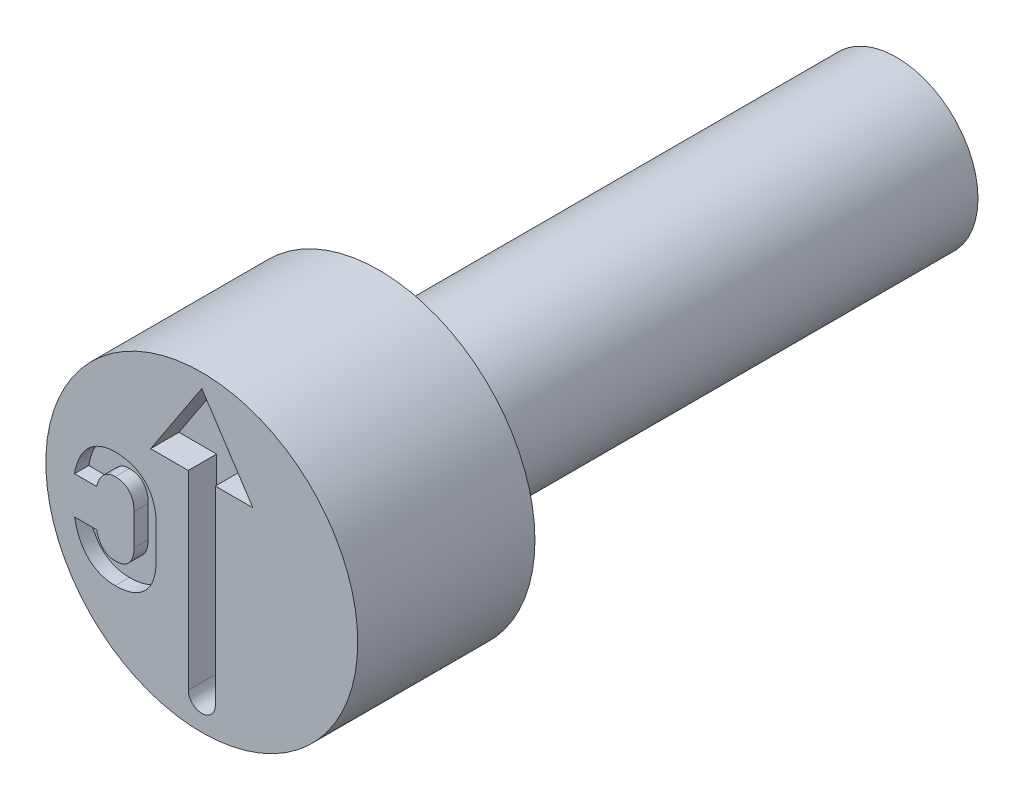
SolidWorks part; units mm, degrees
ref_plane "Front Plane" through (0, 0, 0) normal (0, 0, 1) x (1, 0, 0)
ref_plane "Top Plane" through (0, 0, 0) normal (0, 1, 0) x (1, 0, 0)
ref_plane "Right Plane" through (0, 0, 0) normal (1, 0, 0) x (0, 0, -1)
sketch "Sketch2" plane through (0, 0, 0) normal (1, 0, 0) x (0, 0, -1)
  line L0 (0.4039, 0) -> (50000.4039, 0) construction
  line L6 (0, 2.2) -> (0, 0)
  line L7 (2.5, 2.2) -> (0, 2.2)
  line L8 (2.5, 1.15) -> (2.5, 2.2)
  line L9 (9.8, 1.15) -> (2.5, 1.15)
  line L10 (9.8, 0) -> (9.8, 1.15)
  line L11 (0, 0) -> (9.8, 0)
  dimension "D1" = 4.4
  dimension "D2" = 2.3
  dimension "D3" = 9.8
  dimension "D4" = 2.5
revolve "Revolve1" add sketch "Sketch2" angle 360 about L0
sketch "Sketch3" plane through (0, 0, 0) normal (0, 0, 1) x (1, 0, 0)
  line L0 (0, 0) -> (0, 100000) construction
  line L1 (0.1905, 0.9064) -> (0.1905, -1.7762)
  line L2 (0.7219, 0.9064) -> (0.1905, 0.9064)
  line L3 (0, 2.0021) -> (0.7219, 0.9064)
  line L15 (0, 2.0021) -> (-0.7219, 0.9064)
  line L16 (-0.7219, 0.9064) -> (-0.1905, 0.9064)
  line L17 (-0.1905, 0.9064) -> (-0.1905, -1.7762)
  arc A2 (-0.1905, -1.7762) -> (0.1905, -1.7762) centre (0, -1.7762) ccw
extrude "Cut-Extrude4" cut sketch "Sketch3" against normal blind 0.4
sketch "Sketch4" plane through (0, 0, 0) normal (0, 0, 1) x (1, 0, 0)
  text T0 "C" font "Bahnschrift" height 1.6
  dimension "D1" = 1
  dimension "D2" = 0.5
extrude "Cut-Extrude5" cut sketch "Sketch4" against normal blind 0.2
